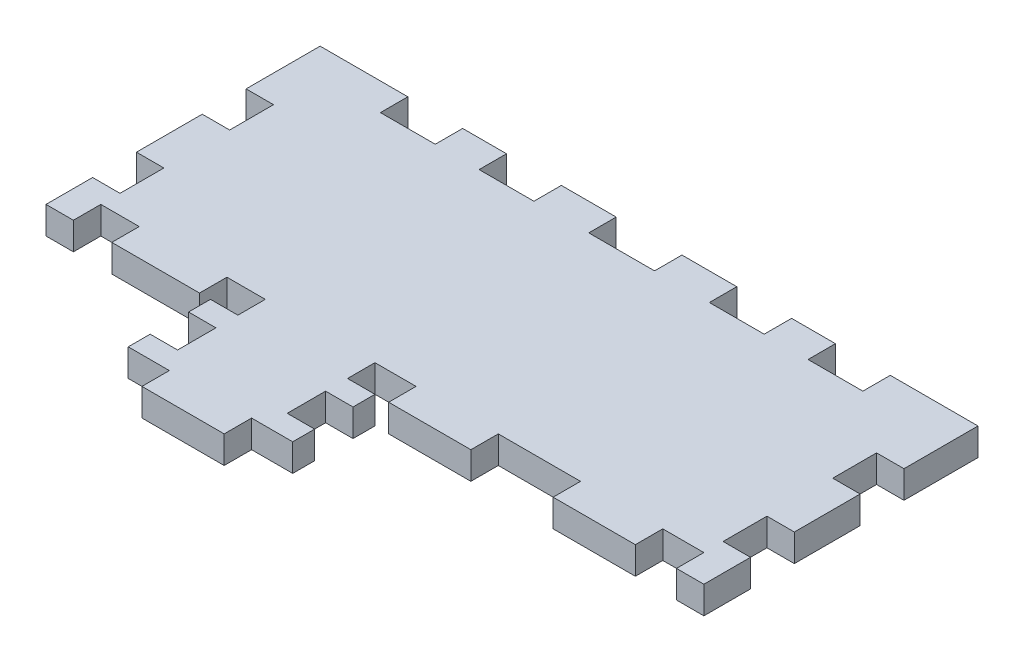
SolidWorks part; units mm, degrees
ref_plane "Front Plane" through (0, 0, 0) normal (0, 0, 1) x (1, 0, 0)
ref_plane "Top Plane" through (0, 0, 0) normal (0, 1, 0) x (1, 0, 0)
ref_plane "Right Plane" through (0, 0, 0) normal (1, 0, 0) x (0, 0, -1)
sketch "Sketch1" plane through (0, 0, 0) normal (0, 1, 0) x (1, 0, 0)
  line L0 (-26.67, 57.15) -> (-26.67, 63.5) construction
  line L1 (-152.4, 0) -> (0, 0)
  line L2 (-152.4, 0) -> (-152.4, 63.5)
  line L3 (-152.4, 63.5) -> (0, 63.5)
  line L4 (0, 0) -> (0, 63.5)
  line L5 (-114.3, 0) -> (-76.2, 0)
  line L6 (-114.3, 0) -> (-114.3, -25.4)
  line L7 (-114.3, -25.4) -> (-76.2, -25.4)
  line L8 (-76.2, 0) -> (-76.2, -25.4)
  line L9 (-132.08, 63.5) -> (-119.38, 63.5)
  line L10 (-132.08, 63.5) -> (-132.08, 57.15)
  line L11 (-132.08, 57.15) -> (-119.38, 57.15)
  line L12 (-119.38, 63.5) -> (-119.38, 57.15)
  line L13 (-109.22, 63.5) -> (-96.52, 63.5)
  line L14 (-109.22, 63.5) -> (-109.22, 57.15)
  line L15 (-109.22, 57.15) -> (-96.52, 57.15)
  line L16 (-96.52, 63.5) -> (-96.52, 57.15)
  line L17 (-83.82, 63.5) -> (-68.58, 63.5)
  line L18 (-83.82, 63.5) -> (-83.82, 57.15)
  line L19 (-83.82, 57.15) -> (-68.58, 57.15)
  line L20 (-68.58, 63.5) -> (-68.58, 57.15)
  line L21 (-55.88, 63.5) -> (-43.18, 63.5)
  line L22 (-55.88, 63.5) -> (-55.88, 57.15)
  line L23 (-55.88, 57.15) -> (-43.18, 57.15)
  line L24 (-43.18, 63.5) -> (-43.18, 57.15)
  line L25 (-20.32, 63.5) -> (-33.02, 63.5)
  line L26 (-20.32, 63.5) -> (-20.32, 57.15)
  line L27 (-20.32, 57.15) -> (-33.02, 57.15)
  line L28 (-33.02, 63.5) -> (-33.02, 57.15)
  line L29 (0, 46.355) -> (-6.35, 46.355)
  line L30 (0, 46.355) -> (0, 36.195)
  line L31 (0, 36.195) -> (-6.35, 36.195)
  line L32 (-6.35, 46.355) -> (-6.35, 36.195)
  line L33 (0, 20.955) -> (-6.35, 20.955)
  line L34 (0, 20.955) -> (0, 10.795)
  line L35 (0, 10.795) -> (-6.35, 10.795)
  line L36 (-6.35, 20.955) -> (-6.35, 10.795)
  line L37 (-152.4, 46.355) -> (-146.05, 46.355)
  line L38 (-152.4, 46.355) -> (-152.4, 36.195)
  line L39 (-152.4, 36.195) -> (-146.05, 36.195)
  line L40 (-146.05, 46.355) -> (-146.05, 36.195)
  line L41 (-152.4, 20.955) -> (-146.05, 20.955)
  line L42 (-152.4, 20.955) -> (-152.4, 10.795)
  line L43 (-152.4, 10.795) -> (-146.05, 10.795)
  line L44 (-146.05, 20.955) -> (-146.05, 10.795)
  line L45 (-6.35, 0) -> (-15.875, 0)
  line L46 (-6.35, 0) -> (-6.35, 6.35)
  line L47 (-6.35, 6.35) -> (-15.875, 6.35)
  line L48 (-15.875, 0) -> (-15.875, 6.35)
  line L49 (-34.925, 0) -> (-53.975, 0)
  line L50 (-34.925, 0) -> (-34.925, 6.35)
  line L51 (-34.925, 6.35) -> (-53.975, 6.35)
  line L52 (-53.975, 0) -> (-53.975, 6.35)
  line L53 (-73.025, 0) -> (-82.55, 0)
  line L54 (-73.025, 0) -> (-73.025, 6.35)
  line L55 (-73.025, 6.35) -> (-82.55, 6.35)
  line L56 (-82.55, 0) -> (-82.55, 6.35)
  line L57 (-146.05, 0) -> (-137.16, 0)
  line L58 (-76.2, -5.08) -> (-82.55, -5.08)
  line L59 (-76.2, -5.08) -> (-76.2, -13.97)
  line L60 (-76.2, -13.97) -> (-82.55, -13.97)
  line L61 (-82.55, -5.08) -> (-82.55, -13.97)
  line L62 (-114.3, -5.08) -> (-107.95, -5.08)
  line L63 (-114.3, -5.08) -> (-114.3, -13.97)
  line L64 (-114.3, -13.97) -> (-107.95, -13.97)
  line L65 (-107.95, -5.08) -> (-107.95, -13.97)
  line L66 (-146.05, 0) -> (-146.05, 6.35)
  line L67 (-146.05, 6.35) -> (-137.16, 6.35)
  line L68 (-137.16, 0) -> (-137.16, 6.35)
  line L69 (-116.84, 0) -> (-107.95, 0)
  line L70 (-116.84, 0) -> (-116.84, 6.35)
  line L71 (-116.84, 6.35) -> (-107.95, 6.35)
  line L72 (-107.95, 0) -> (-107.95, 6.35)
  line L73 (-114.3, -19.05) -> (-104.775, -19.05)
  line L74 (-114.3, -19.05) -> (-114.3, -25.4)
  line L75 (-114.3, -25.4) -> (-104.775, -25.4)
  line L76 (-104.775, -19.05) -> (-104.775, -25.4)
  line L77 (-76.2, -19.05) -> (-85.725, -19.05)
  line L78 (-76.2, -19.05) -> (-76.2, -25.4)
  line L79 (-76.2, -25.4) -> (-85.725, -25.4)
  line L80 (-85.725, -19.05) -> (-85.725, -25.4)
  line L82 (-30.2952, 76.3589) -> (-23.0448, 76.3589)
  dimension "D1" = 152.4
  dimension "D2" = 63.5
  dimension "D3" = 38.1
  dimension "D4" = 38.1
  dimension "D5" = 25.4
  dimension "D6" = 20.32
  dimension "D7" = 12.7
  dimension "D8" = 10.16
  dimension "D9" = 12.7
  dimension "D10" = 12.7
  dimension "D11" = 15.24
  dimension "D12" = 20.32
  dimension "D13" = 12.7
  dimension "D14" = 10.16
  dimension "D15" = 12.7
  dimension "D16" = 6.35
  dimension "D17" = 6.35
  dimension "D18" = 6.35
  dimension "D19" = 6.35
  dimension "D20" = 6.35
  dimension "D21" = 6.35
  dimension "D22" = 6.35
  dimension "D23" = 10.16
  dimension "D24" = 10.16
  dimension "D25" = 15.24
  dimension "D26" = 17.145
  dimension "D27" = 6.35
  dimension "D28" = 6.35
  dimension "D29" = 10.16
  dimension "D30" = 10.16
  dimension "D31" = 17.145
  dimension "D32" = 15.24
  dimension "D33" = 6.35
  dimension "D34" = 6.35
  dimension "D35" = 6.35
  dimension "D36" = 6.35
  dimension "D37" = 9.525
  dimension "D38" = 19.05
  dimension "D39" = 9.525
  dimension "D40" = 19.05
  dimension "D41" = 19.05
  dimension "D42" = 8.89
  dimension "D43" = 8.89
  dimension "D44" = 5.08
  dimension "D45" = 5.08
  dimension "D46" = 6.35
  dimension "D47" = 6.35
  dimension "D48" = 6.35
  dimension "D49" = 8.89
  dimension "D50" = 8.89
  dimension "D51" = 6.35
  dimension "D52" = 6.35
  dimension "D53" = 20.32
  dimension "D54" = 6.35
  dimension "D55" = 6.35
  dimension "D56" = 9.525
  dimension "D57" = 9.525
extrude "Boss-Extrude1" add sketch "Sketch1" along normal blind 6.35 contours L28 L3 L24 L23 L22 L20 L19 L18 L16 L15 L14 L12 L11 L10 L2 L1 L4 L26 L27 | L8 L1 L6 L7
sketch "Sketch3" plane through (0, 0, -57.15) normal (0, 0, -1) x (-1, 0, 0)
  line L0 (20.32, 3.175) -> (33.02, 3.175) construction
  line L1 (20.32, 6.35) -> (20.32, 0) construction
  line L2 (33.02, 6.35) -> (33.02, 0) construction
  circle A0 centre (26.67, 3.175) radius 1.905
  dimension "D1" = 3.81
extrude "Cut-Extrude1" cut sketch "Sketch3" against normal blind 19.05
sketch "Sketch5" plane through (0, 0, -57.15) normal (0, 0, -1) x (-1, 0, 0)
  line L0 (119.38, 3.175) -> (132.08, 3.175) construction
  line L1 (119.38, 6.35) -> (119.38, 0) construction
  line L2 (132.08, 6.35) -> (132.08, 0) construction
  circle A0 centre (125.73, 3.175) radius 1.905
  dimension "D1" = 3.81
extrude "Cut-Extrude3" cut sketch "Sketch5" against normal blind 19.05
